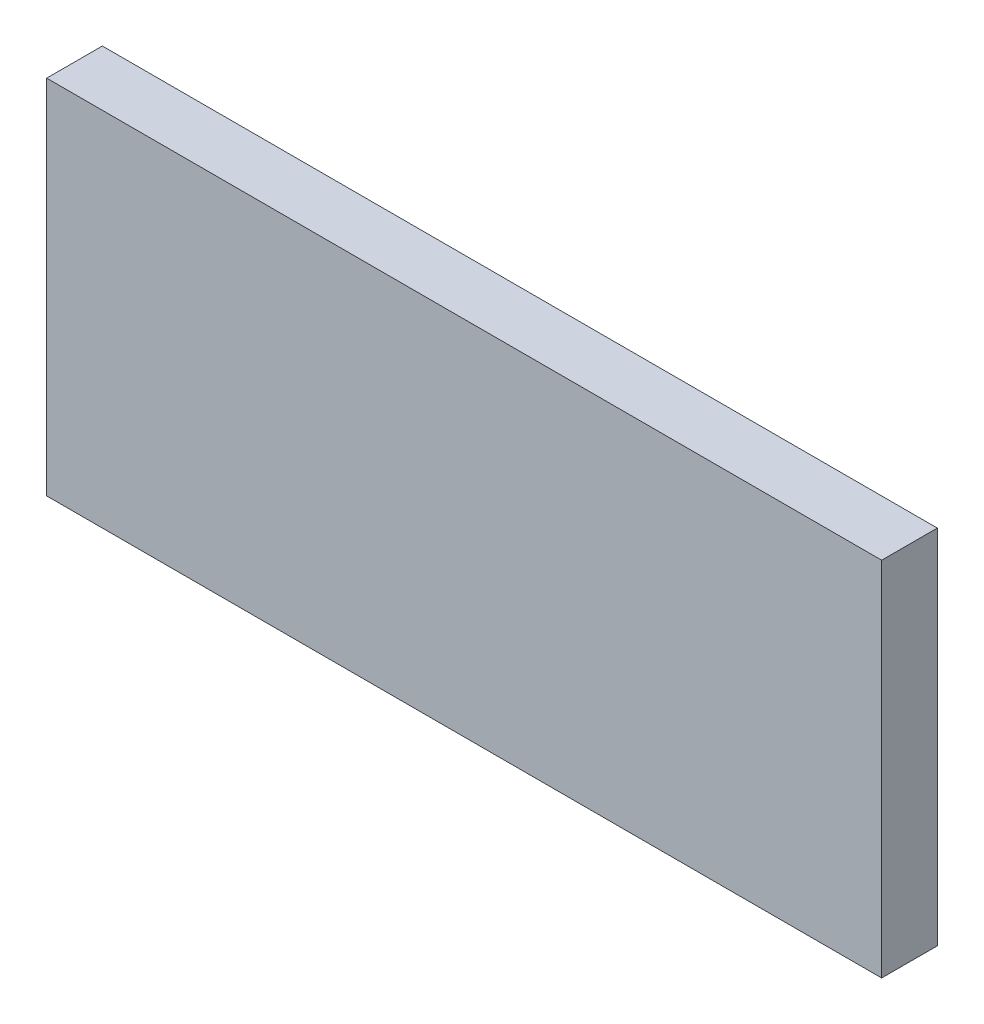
SolidWorks part; units mm, degrees
ref_plane "Ebene vorne" through (0, 0, 0) normal (0, 0, 1) x (1, 0, 0)
ref_plane "Ebene oben" through (0, 0, 0) normal (0, 1, 0) x (1, 0, 0)
ref_plane "Ebene rechts" through (0, 0, 0) normal (1, 0, 0) x (0, 0, -1)
sketch "Skizze1" plane through (0, 0, 0) normal (0, 1, 0) x (1, 0, 0)
  line L1 (0, 0) -> (-300, 0)
  line L2 (0, 0) -> (0, -20)
  line L3 (0, -20) -> (-300, -20)
  line L4 (-300, 0) -> (-300, -20)
  dimension "D1" = 300
  dimension "D2" = 20
extrude "Aufsatz-Linear austragen1" add sketch "Skizze1" along normal blind 130
